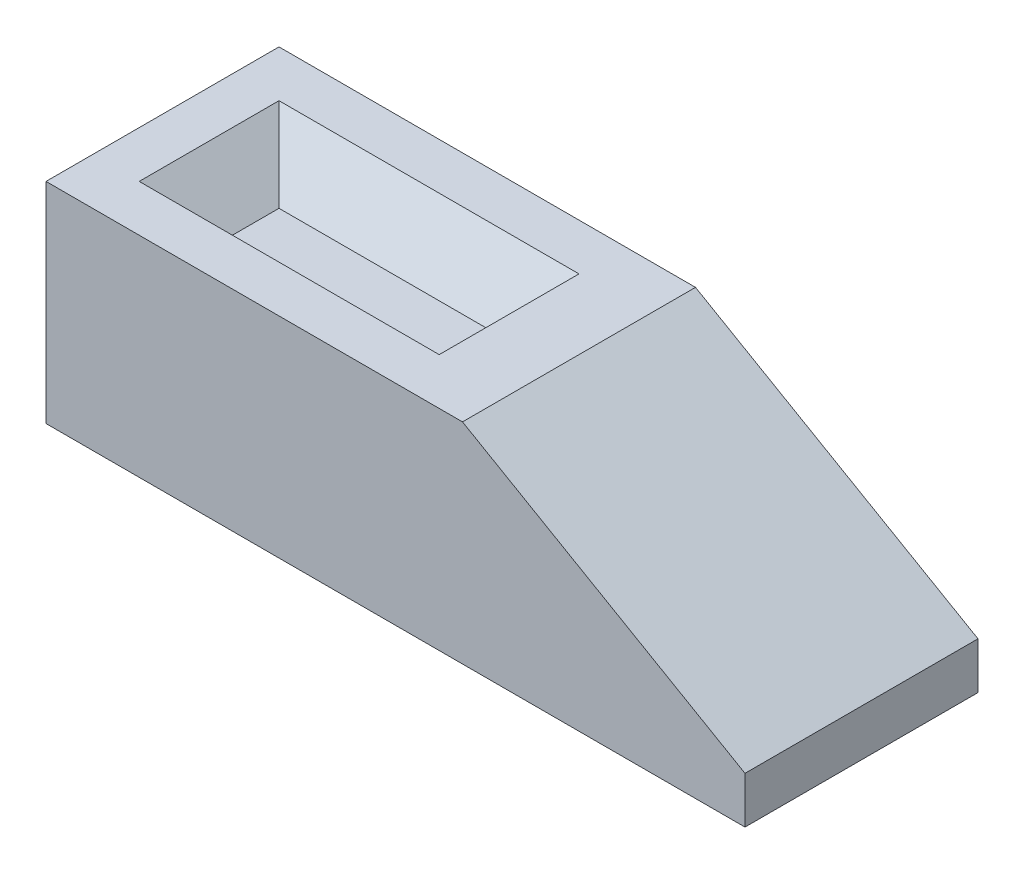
SolidWorks part; units mm, degrees
ref_plane "Front Plane" through (0, 0, 0) normal (0, 0, 1) x (1, 0, 0)
ref_plane "Top Plane" through (0, 0, 0) normal (0, 1, 0) x (1, 0, 0)
ref_plane "Right Plane" through (0, 0, 0) normal (1, 0, 0) x (0, 0, -1)
sketch "Sketch1" plane through (0, 0, 0) normal (0, 0, 1) x (1, 0, 0)
  line L0 (0, 0) -> (0, 10)
  line L1 (0, 10) -> (-60.6218, 45)
  line L2 (-60.6218, 45) -> (-150, 45)
  line L3 (-150, 45) -> (-150, 0)
  line L4 (-150, 0) -> (0, 0)
  dimension "D1" = 150
  dimension "D2" = 10
  dimension "D3" = 30
  dimension "D4" = 45
extrude "Extrude1" add sketch "Sketch1" along normal mid plane 50
sketch "Sketch2" plane through (0, 45, 0) normal (0, 1, 0) x (-1, 0, 0)
  line L4 (60.6218, 25) -> (60.6218, -25) construction
  line L5 (150, 25) -> (150, -25) construction
  line L6 (150, 0) -> (75.6218, 0) construction
  line L12 (75.6218, -15) -> (140, -15)
  line L13 (140, -15) -> (140, 15)
  line L14 (140, 15) -> (75.6218, 15)
  line L15 (75.6218, 15) -> (75.6218, -15)
  dimension "D1" = 15
  dimension "D2" = 10
  dimension "D3" = 30
extrude "Cut-Extrude1" cut sketch "Sketch2" against normal blind 10 draft 45
